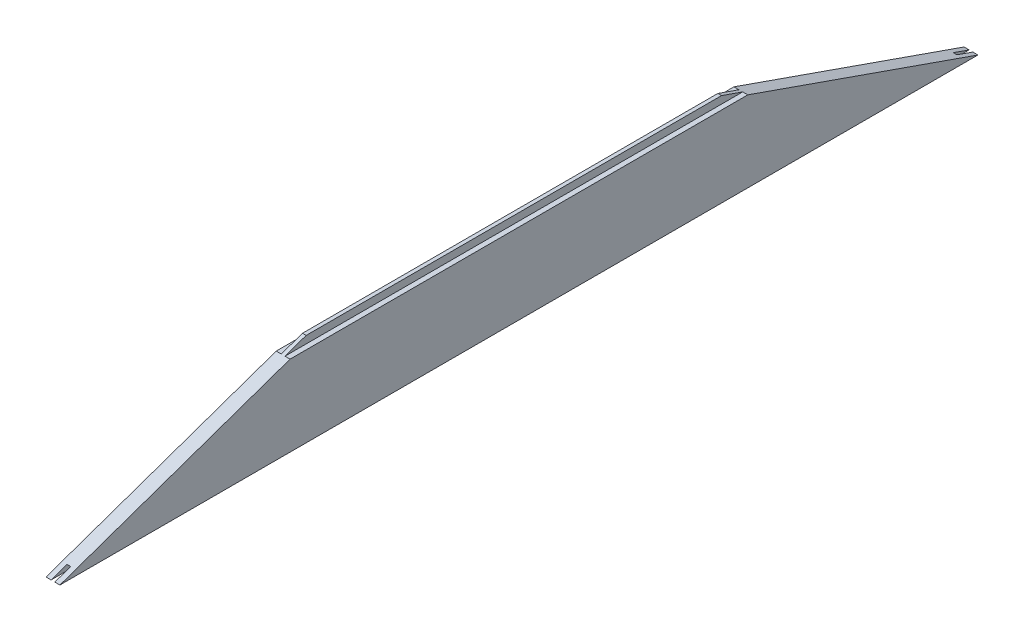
SolidWorks part; units mm, degrees
ref_plane "Plan de face" through (0, 0, 0) normal (0, 0, 1) x (1, 0, 0)
ref_plane "Plan de dessus" through (0, 0, 0) normal (0, 1, 0) x (1, 0, 0)
ref_plane "Plan de droite" through (0, 0, 0) normal (1, 0, 0) x (0, 0, -1)
sketch "Esquisse1" plane through (0, 0, 0) normal (0, 0, 1) x (1, 0, 0)
  line L1 (-7.5, 43.5) -> (7.5, 43.5)
  line L2 (-7.5, 43.5) -> (-7.5, -43.5)
  line L3 (-7.5, -43.5) -> (7.5, -43.5)
  line L4 (7.5, 43.5) -> (7.5, -43.5)
  line L5 (-7.5, 43.5) -> (7.5, -43.5) construction
  line L6 (-7.5, -43.5) -> (7.5, 43.5) construction
  line L7 (-2, 51.5) -> (2, 51.5)
  line L8 (-2, 51.5) -> (-2, 35.5)
  line L9 (-2, 35.5) -> (2, 35.5)
  line L10 (2, 51.5) -> (2, 35.5)
  line L11 (-2, 51.5) -> (2, 35.5) construction
  line L12 (-2, 35.5) -> (2, 51.5) construction
  line L13 (-2, -37.5) -> (2, -37.5)
  line L14 (-2, -37.5) -> (-2, -49.5)
  line L15 (-2, -49.5) -> (2, -49.5)
  line L16 (2, -37.5) -> (2, -49.5)
  line L17 (-2, -37.5) -> (2, -49.5) construction
  line L18 (-2, -49.5) -> (2, -37.5) construction
  point P0 (0, 0)
  point P5 (0, 43.5)
  point P11 (0, -43.5)
  dimension "D1" = 87
  dimension "D2" = 15
  dimension "D3" = 4
  dimension "D4" = 16
  dimension "D5" = 4
  dimension "D6" = 12
extrude "Boss.-Extru.1" add sketch "Esquisse1" along normal blind 991.4 contours L10 L7 L8 L1 | L10 L1 L8 L9 | L13 L16 L3 L4 L1 L10 L9 L8 L2 L14
sketch "Esquisse2" plane through (0, 0, 0) normal (1, 0, 0) x (0, 0, -1)
  line L0 (-991.4, -43.5) -> (0, -43.5) construction
  line L1 (-991.4, -43.5) -> (-911.1097, -15.3985)
  line L2 (-991.4, -43.5) -> (-719.9707, 51.5)
  line L3 (-991.4, 51.5) -> (0, 51.5) construction
  line L4 (-719.9707, 51.5) -> (-991.4, 51.5)
  line L5 (-991.4, 51.5) -> (-991.4, -43.5)
  line L6 (-991.4, -43.5) -> (-992.4429, -42.5056)
  line L7 (0, -43.5) -> (-112.8789, -3.9925)
  line L8 (0, -43.5) -> (-271.4293, 51.5)
  line L9 (-271.4293, 51.5) -> (0, 51.5)
  line L10 (0, 51.5) -> (0, -43.5)
  arc A0 (-906.334, -43.5) -> (-911.1097, -15.3985) centre (-991.4, -43.5) ccw
  arc A1 (-119.593, -43.5) -> (-112.8789, -3.9925) centre (0, -43.5) cw
extrude "Enlèv. mat.-Extru.1" cut sketch "Esquisse2" against normal through all both and the other way through all contours L8 L9 L10 | L2 L4 L5
